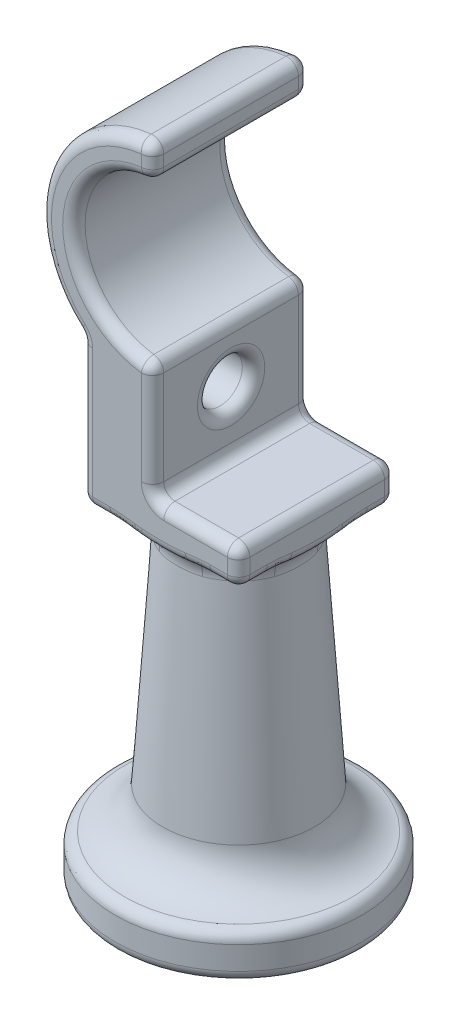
SolidWorks part; units mm, degrees
ref_plane "Alzado" through (0, 0, 0) normal (0, 0, 1) x (1, 0, 0)
ref_plane "Planta" through (0, 0, 0) normal (0, 1, 0) x (1, 0, 0)
ref_plane "Vista lateral" through (0, 0, 0) normal (1, 0, 0) x (0, 0, -1)
sketch "Croquis2" plane through (0, 0, 0) normal (1, 0, 0) x (0, 0, -1)
  line L0 (0, 0) -> (0, 81.2272) construction
  line L1 (0, 0) -> (-33, 0)
  line L2 (-33, 0) -> (-33, 12)
  line L3 (-33, 12) -> (-21, 12)
  line L4 (-21, 12) -> (-16, 88)
  line L5 (-16, 88) -> (0, 88)
  line L6 (0, 88) -> (0, 0)
  dimension "D1" = 12
  dimension "D2" = 66
  dimension "D3" = 32
  dimension "D4" = 42
  dimension "D5" = 88
revolve "Revolución1" add sketch "Croquis2" angle 360 about L0
sketch "Croquis3" plane through (0, 88, 0) normal (0, 1, 0) x (1, 0, 0)
  line L1 (21, 21) -> (-21, 21)
  line L2 (21, 21) -> (21, -21)
  line L3 (21, -21) -> (-21, -21)
  line L4 (-21, 21) -> (-21, -21)
  line L5 (21, 21) -> (-21, -21) construction
  line L6 (21, -21) -> (-21, 21) construction
  point P0 (0, 0)
  dimension "D1" = 42
  dimension "D2" = 42
extrude "Saliente-Extruir1" add sketch "Croquis3" along normal blind 10
sketch "Croquis4" plane through (0, 0, 21) normal (0, 0, 1) x (1, 0, 0)
  line L0 (-21, 98) -> (-21, 126.7836)
  line L1 (-2, 98) -> (-2, 129)
  line L2 (-21, 98) -> (21, 98) construction
  line L3 (-2, 171) -> (-2, 180)
  line L4 (-21, 98) -> (-2, 98)
  arc A0 (-2, 129) -> (-2, 171) centre (-2, 150) cw
  arc A1 (-2, 180) -> (-21, 126.7836) centre (-2, 150) ccw
  dimension "D3" = 21
  dimension "D5" = 30
  dimension "D1" = 19
  dimension "D2" = 52
  dimension "D4" = 9
extrude "Saliente-Extruir2" add sketch "Croquis4" against normal up to surface (42 mm away)
sketch "Croquis5" plane through (-2, 0, 0) normal (1, 0, 0) x (0, 0, -1)
  line L0 (-21, 98) -> (-21, 129) construction
  line L1 (21, 98) -> (-21, 98) construction
  circle A0 centre (0, 114) radius 6
  dimension "D1" = 12
  dimension "D2" = 21
  dimension "D3" = 16
extrude "Cortar-Extruir1" cut sketch "Croquis5" against normal through all
fillet "Redondeo1" radius 12 1 edges at (0, 12, -21)
fillet "Redondeo2" radius 6 1 edges at (0, 88, -16)
fillet "Redondeo4" radius 3 6 edges at (21, 98, 0)
fillet "Redondeo5" radius 3 31 edges at (-22.9461, 151.5039, -21) (-2.6571, 129.0103, -19.8738) (-22.9461, 151.5039, 21) (-3.1343, 129.0307, 20.3493) (-2, 129, 0) (20.1213, 97.1213, -20.1213) (20.1213, 97.1213, 20.1213) (-2, 171, 0) (-2, 180, 0) (-21, 126.7836, 0) (-21, 88, 14.4085) (-21, 88, 0) (-21, 88, -14.4085) (-21, 114, -6) (21, 88, -14.4085) (21, 88, 0) (21, 88, 14.4085) (-2, 175.5, -21) (-2, 175.5, 21) (-30.2532, 160.0873, -21) (-30.2532, 160.0873, 21) (-21, 107.3918, -21) (-14.4085, 88, -21) (0, 88, -21) (14.4085, 88, -21) (21, 91.5, -21) (21, 91.5, 21) (14.4085, 88, 21) (0, 88, 21) (-14.4085, 88, 21) (-21, 107.3918, 21)
fillet "Redondeo6" radius 3 2 edges at (0, 0, -33) (0, 12, -33)
fillet "Redondeo7" radius 3 1 edges at (-2, 114, -6)
